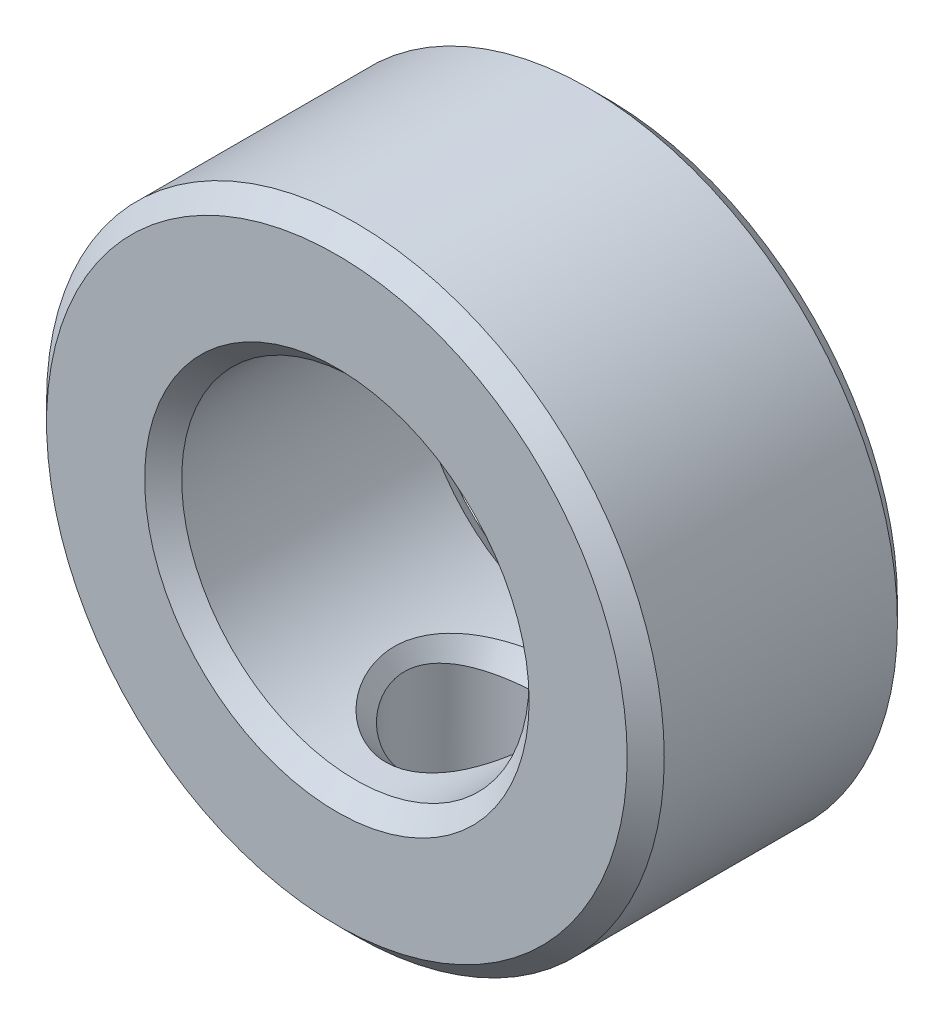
SolidWorks part; units mm, degrees
ref_plane "Front Plane" through (0, 0, 0) normal (0, 0, 1) x (1, 0, 0)
ref_plane "Top Plane" through (0, 0, 0) normal (0, 1, 0) x (1, 0, 0)
ref_plane "Right Plane" through (0, 0, 0) normal (1, 0, 0) x (0, 0, -1)
sketch "Sketch1" plane through (0, 0, 0) normal (0, 0, 1) x (1, 0, 0)
  circle A0 centre (0, 0) radius 12.7
  circle A1 centre (0, 0) radius 7.1438
  dimension "D1" = 25.4
  dimension "D2" = 14.2875
extrude "Extrude1" add sketch "Sketch1" along normal mid plane 11.1125
chamfer "Chamfer1" distance 0.762 angle 45 4 edges at (7.1438, 0, -5.5562) (7.1438, 0, 5.5562) (12.7, 0, -5.5562) (12.7, 0, 5.5562)
sketch "Sketch2" plane through (0, 0, 0) normal (0, 1, 0) x (1, 0, 0)
  circle A0 centre (0, 0) radius 2.7781
  dimension "D1" = 5.5562
extrude "Cut-Extrude1" cut sketch "Sketch2" against normal blind 25.4
chamfer "Chamfer2" distance 0.762 angle 45 2 edges at (-0.5653, -12.6874, -2.72) (-0.4151, -7.1317, -2.7469)
